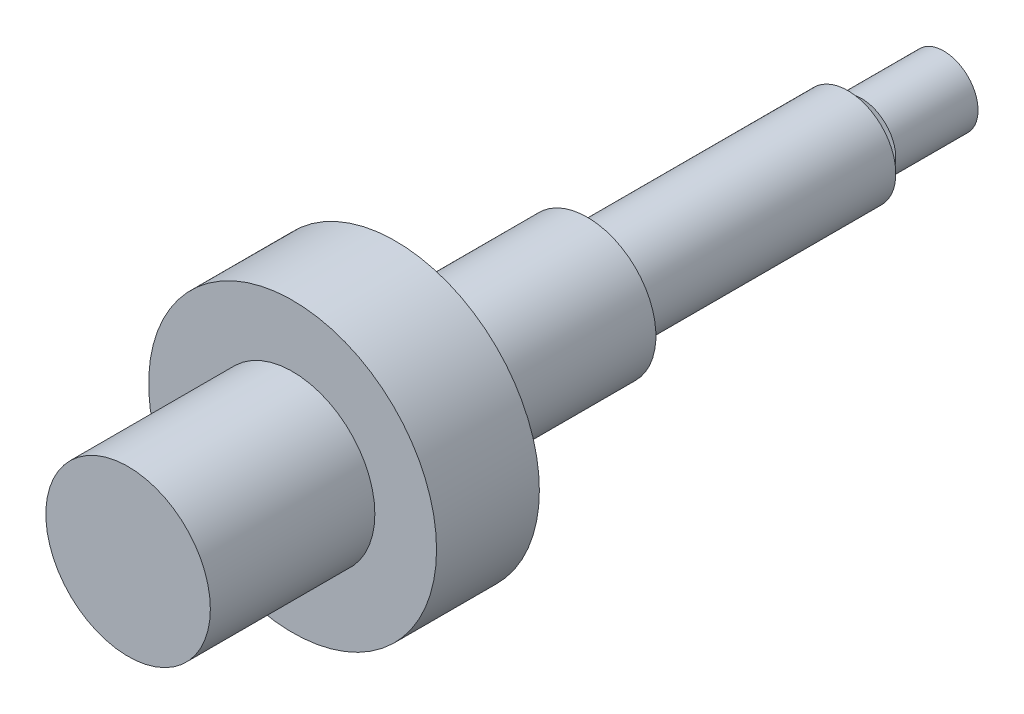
SolidWorks part; units mm, degrees
ref_plane "前视基准面" through (0, 0, 0) normal (0, 0, 1) x (1, 0, 0)
ref_plane "上视基准面" through (0, 0, 0) normal (0, 1, 0) x (1, 0, 0)
ref_plane "右视基准面" through (0, 0, 0) normal (1, 0, 0) x (0, 0, -1)
sketch "草图1" plane through (0, 0, 0) normal (0, 0, 1) x (1, 0, 0)
  circle A0 centre (0, 0) radius 10.5
  dimension "D1" = 21
extrude "拉伸1" add sketch "草图1" along normal up to surface (7.5 mm away)
sketch "草图2" plane through (0, 0, 7.5) normal (0, 0, 1) x (1, 0, 0)
  circle A0 centre (0, 0) radius 6
  dimension "D1" = 12
extrude "拉伸2" add sketch "草图2" along normal blind 12
sketch "草图3" plane through (0, 0, 0) normal (0, 0, -1) x (-1, 0, 0)
  circle A0 centre (0, 0) radius 4.5
  dimension "D1" = 9
extrude "拉伸3" add sketch "草图3" along normal blind 1
sketch "草图4" plane through (0, 0, -1) normal (0, 0, -1) x (-1, 0, 0)
  circle A0 centre (0, 0) radius 5
  dimension "D1" = 10
extrude "拉伸4" add sketch "草图4" along normal up to surface (13 mm away)
sketch "草图5" plane through (0, 0, -14) normal (0, 0, -1) x (-1, 0, 0)
  circle A0 centre (0, 0) radius 2.5
  dimension "D1" = 5
extrude "拉伸5" add sketch "草图5" along normal blind 1
sketch "草图6" plane through (0, 0, -15) normal (0, 0, -1) x (-1, 0, 0)
  circle A0 centre (0, 0) radius 3.5
  dimension "D1" = 7
extrude "拉伸6" add sketch "草图6" along normal blind 18
sketch "草图7" plane through (0, 0, -33) normal (0, 0, -1) x (-1, 0, 0)
  circle A0 centre (0, 0) radius 1.5
  dimension "D1" = 3
extrude "拉伸7" add sketch "草图7" along normal blind 1
sketch "草图8" plane through (0, 0, -34) normal (0, 0, -1) x (-1, 0, 0)
  circle A0 centre (0, 0) radius 2.5
  dimension "D1" = 5
extrude "拉伸8" add sketch "草图8" along normal blind 6
